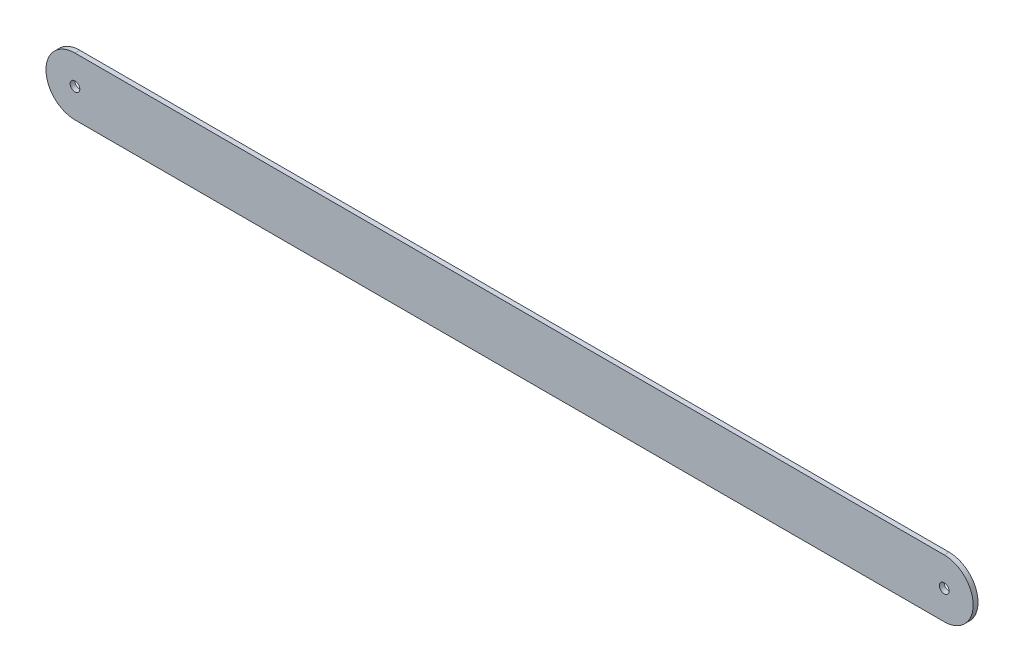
SolidWorks part; units mm, degrees
ref_plane "Front Plane" through (0, 0, 0) normal (0, 0, 1) x (1, 0, 0)
ref_plane "Top Plane" through (0, 0, 0) normal (0, 1, 0) x (1, 0, 0)
ref_plane "Right Plane" through (0, 0, 0) normal (1, 0, 0) x (0, 0, -1)
sketch "Sketch2" plane through (0, 0, 0) normal (0, 0, 1) x (1, 0, 0)
  line L0 (0, 0) -> (180, 0) construction
  line L1 (0, 6) -> (180, 6)
  line L2 (0, -6) -> (180, -6)
  arc A0 (0, 6) -> (0, -6) centre (0, 0) ccw
  arc A1 (180, -6) -> (180, 6) centre (180, 0) ccw
  circle A2 centre (0, 0) radius 1
  circle A3 centre (180, 0) radius 1
  point P3 (90, 0)
  dimension "D2" = 6
  dimension "D3" = 2
  dimension "D4" = 2
  dimension "D1" = 180
extrude "Boss-Extrude1" add sketch "Sketch2" along normal blind 1
